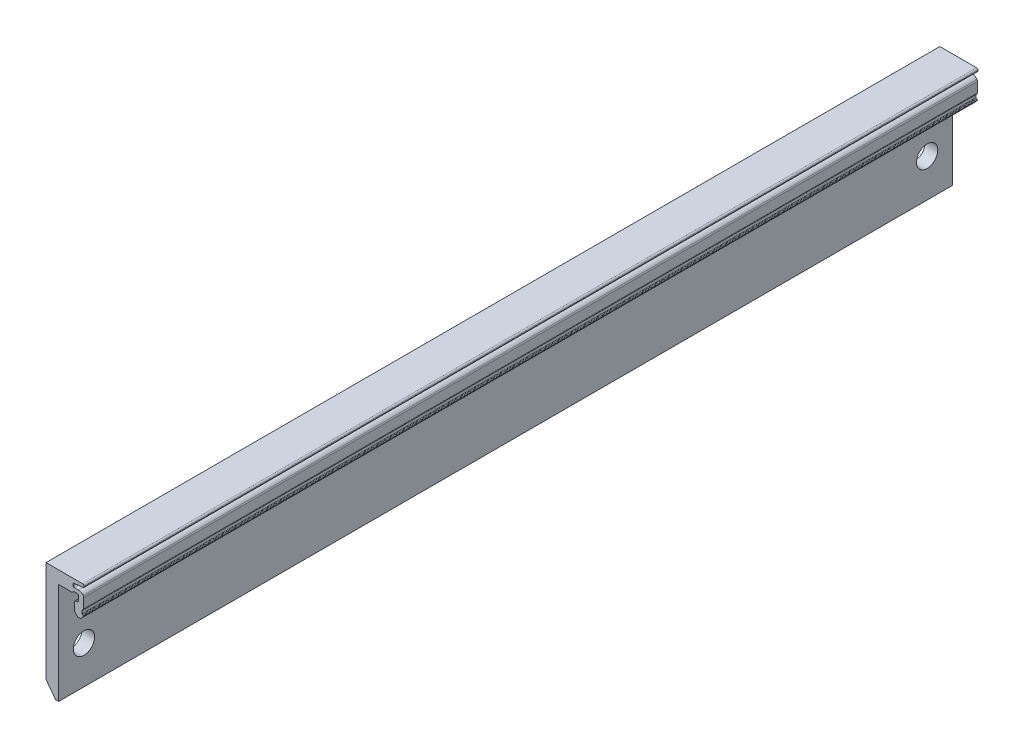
SolidWorks part; units mm, degrees
ref_plane "前视基准面" through (0, 0, 0) normal (0, 0, 1) x (1, 0, 0)
ref_plane "上视基准面" through (0, 0, 0) normal (0, 1, 0) x (1, 0, 0)
ref_plane "右视基准面" through (0, 0, 0) normal (1, 0, 0) x (0, 0, -1)
sketch "草图1" plane through (0, 0, 0) normal (0, 0, 1) x (1, 0, 0)
  line L0 (2350.384, -3290.1038) -> (2355.384, -3290.1038)
  line L2 (2352.884, -3292.6038) -> (2355.384, -3292.6038)
  line L3 (2350.384, -3292.6038) -> (2350.384, -3310.1038)
  line L4 (2352.884, -3292.6038) -> (2352.884, -3312.6038)
  line L5 (2355.384, -3292.6038) -> (2355.384, -3290.1038) construction
  line L6 (2355.384, -3290.1038) -> (2357.924, -3290.1038) construction
  line L7 (2350.384, -3292.6038) -> (2350.384, -3290.1038)
  line L10 (2352.884, -3312.6038) -> (2352.284, -3312.6038)
  line L11 (2350.384, -3310.1038) -> (2352.284, -3312.6038)
  line L12 (2356.524, -3292.3038) -> (2355.988, -3292.3038)
  line L13 (2357.5972, -3295.408) -> (2357.724, -3295.408)
  line L14 (2357.624, -3290.1038) -> (2357.924, -3290.1038) construction
  line L15 (2357.8006, -3295.5917) -> (2357.3831, -3296.0891)
  line L16 (2357.4972, -3294.808) -> (2357.4972, -3295.308)
  line L17 (2357.824, -3295.508) -> (2357.824, -3295.5274)
  line L18 (2357.824, -3292.376) -> (2357.824, -3294.2738)
  line L19 (2356.324, -3293.7038) -> (2356.524, -3293.7038)
  line L20 (2356.024, -3295.4545) -> (2356.024, -3294.0038)
  line L21 (2357.7449, -3290.6914) -> (2355.9031, -3290.8849)
  line L22 (2355.724, -3291.0839) -> (2355.724, -3291.4038)
  line L23 (2355.924, -3291.6038) -> (2356.77, -3291.6038)
  line L24 (2357.924, -3290.4038) -> (2357.924, -3290.4925)
  line L25 (2356.465, -3296.0891) -> (2356.0943, -3295.6474)
  line L26 (2356.824, -3293.4038) -> (2356.824, -3292.6038)
  line L27 (2357.924, -3290.4038) -> (2357.924, -3290.1038) construction
  line L28 (2355.384, -3292.6038) -> (2355.4683, -3292.6038)
  line L29 (2355.384, -3290.1038) -> (2357.624, -3290.1038)
  arc A0 (2357.4972, -3294.808) -> (2357.6606, -3294.5409) centre (2357.7972, -3294.808) cw
  arc A1 (2356.77, -3291.6038) -> (2357.7198, -3292.0704) centre (2356.77, -3292.8038) cw
  arc A2 (2357.824, -3295.5274) -> (2357.8006, -3295.5917) centre (2357.724, -3295.5274) cw
  arc A3 (2355.724, -3291.0839) -> (2355.9031, -3290.8849) centre (2355.924, -3291.0839) cw
  arc A4 (2357.924, -3290.4925) -> (2357.7449, -3290.6914) centre (2357.724, -3290.4925) cw
  arc A5 (2355.7282, -3292.4538) -> (2355.4683, -3292.6038) centre (2355.4683, -3292.3038) cw
  arc A6 (2357.624, -3290.1038) -> (2357.924, -3290.4038) centre (2357.624, -3290.4038) cw
  arc A7 (2357.5972, -3295.408) -> (2357.4972, -3295.308) centre (2357.5972, -3295.308) cw
  arc A8 (2357.824, -3294.2738) -> (2357.6606, -3294.5409) centre (2357.524, -3294.2738) cw
  arc A9 (2355.924, -3291.6038) -> (2355.724, -3291.4038) centre (2355.924, -3291.4038) cw
  arc A10 (2356.524, -3292.3038) -> (2356.824, -3292.6038) centre (2356.524, -3292.6038) cw
  arc A11 (2356.0943, -3295.6474) -> (2356.024, -3295.4545) centre (2356.324, -3295.4545) cw
  arc A12 (2355.7282, -3292.4538) -> (2355.988, -3292.3038) centre (2355.988, -3292.6038) cw
  arc A13 (2357.7198, -3292.0704) -> (2357.824, -3292.376) centre (2357.324, -3292.376) cw
  arc A14 (2356.024, -3294.0038) -> (2356.324, -3293.7038) centre (2356.324, -3294.0038) cw
  arc A15 (2356.824, -3293.4038) -> (2356.524, -3293.7038) centre (2356.524, -3293.4038) cw
  arc A16 (2357.3831, -3296.0891) -> (2356.465, -3296.0891) centre (2356.924, -3295.7038) cw
  arc A17 (2357.724, -3295.408) -> (2357.824, -3295.508) centre (2357.724, -3295.508) cw
  dimension "D1" = 20
  dimension "D2" = 0.6
  dimension "D3" = 2.5
  dimension "D5" = 127.235
extrude "凸台-拉伸1" add sketch "草图1" along normal mid plane 176.45
sketch "草图3" plane through (2350.384, 0, 0) normal (-1, 0, 0) x (0, 0, 1)
  line L0 (-88.225, -3290.1038) -> (-88.225, -3310.1038) construction
  line L1 (88.225, -3290.1038) -> (-88.225, -3290.1038) construction
  line L2 (0, -3290.1038) -> (0, -3328.2905) construction
  circle A0 centre (-83.225, -3305.1038) radius 2.1
  circle A1 centre (83.225, -3305.1038) radius 2.1
  dimension "D1" = 4.2
  dimension "D2" = 5
  dimension "D3" = 15
extrude "切除-拉伸2" cut sketch "草图3" against normal through all
